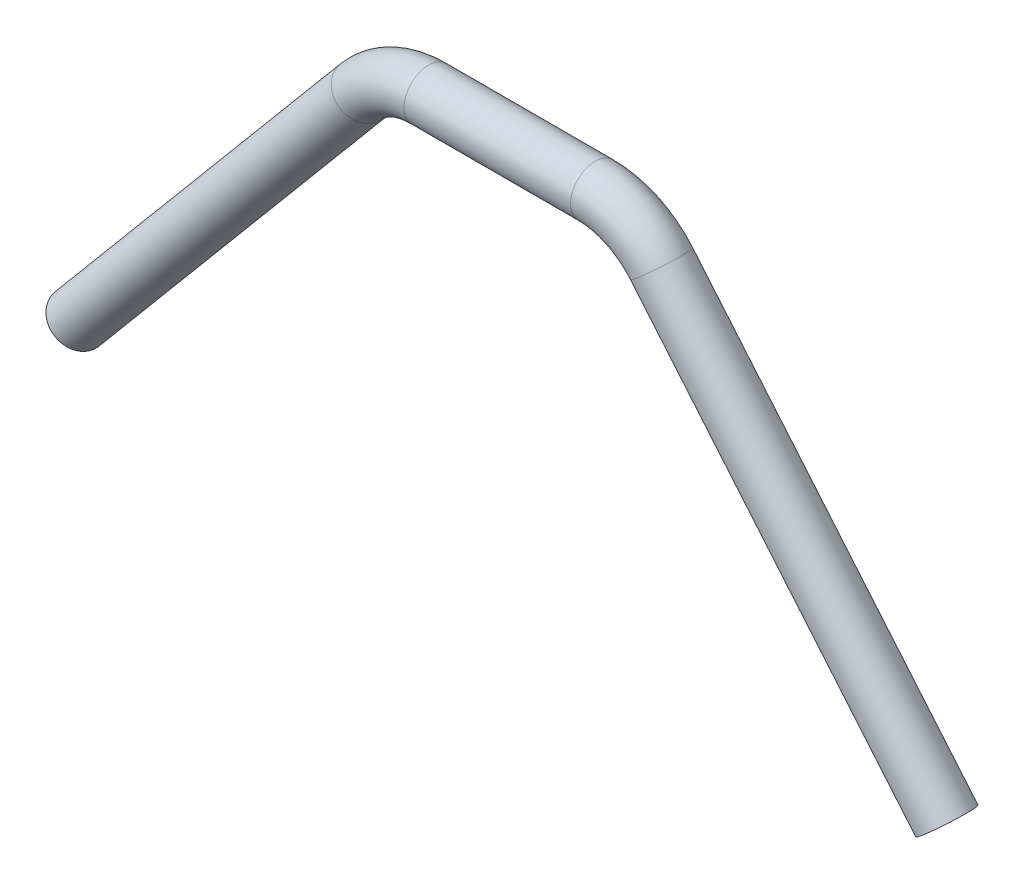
SolidWorks part; units mm, degrees
ref_plane "Ebene vorne" through (0, 0, 0) normal (0, 0, 1) x (1, 0, 0)
ref_plane "Ebene oben" through (0, 0, 0) normal (0, 1, 0) x (1, 0, 0)
ref_plane "Ebene rechts" through (0, 0, 0) normal (1, 0, 0) x (0, 0, -1)
sketch "Skizze1" plane through (0, 0, 0) normal (0, 0, 1) x (1, 0, 0)
  line L1 (0, 0) -> (-33.6792, 0)
  line L2 (-60.4908, -12.5024) -> (-175.8649, -150)
  line L3 (0, 34.0258) -> (0, -80.3148) construction
  arc A0 (-33.6792, 0) -> (-60.4908, -12.5024) centre (-33.6792, -35) ccw
  point P10 (-50, 0)
  point P13 (50, 0)
  dimension "D6" = 35
  dimension "D1" = 50
  dimension "D2" = 50
  dimension "D4" = 150
sketch "Skizze2" plane through (0, 0, 0) normal (1, 0, 0) x (0, 0, -1)
  circle A0 centre (0, 0) radius 10
  circle A1 centre (0, 0) radius 8.5
  dimension "D1" = 20
  dimension "D2" = 1.5
sweep "Austragung3" add profiles "Skizze2" path "Skizze1"
mirror "Spiegeln2" about plane through (0, 0, 0) normal (1, 0, 0) of "Austragung3"
